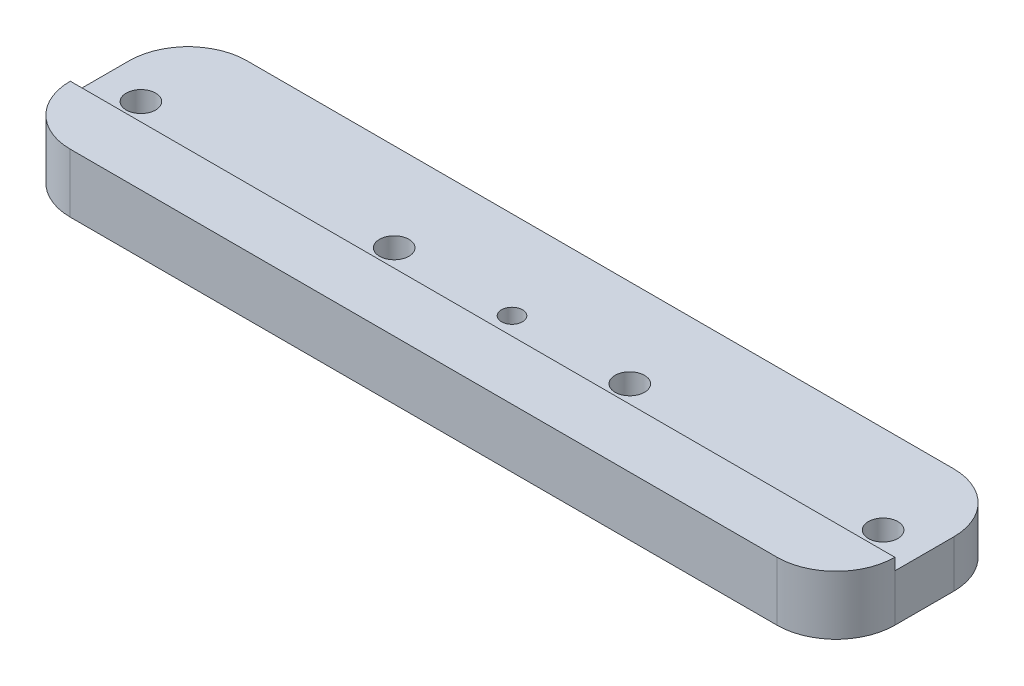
SolidWorks part; units mm, degrees
ref_plane "Front Plane" through (0, 0, 0) normal (0, 0, 1) x (1, 0, 0)
ref_plane "Top Plane" through (0, 0, 0) normal (0, 1, 0) x (1, 0, 0)
ref_plane "Right Plane" through (0, 0, 0) normal (1, 0, 0) x (0, 0, -1)
sketch "Sketch1" plane through (0, 0, 0) normal (0, 1, 0) x (1, 0, 0)
  line L1 (-44.45, -9.525) -> (44.45, -9.525)
  line L2 (-44.45, -9.525) -> (-44.45, 9.525)
  line L3 (-44.45, 9.525) -> (44.45, 9.525)
  line L4 (44.45, -9.525) -> (44.45, 9.525)
  line L5 (-44.45, -9.525) -> (44.45, 9.525) construction
  line L6 (-44.45, 9.525) -> (44.45, -9.525) construction
  point P0 (0, 0)
  dimension "D1" = 88.9
  dimension "D2" = 19.05
extrude "Extrude1" add sketch "Sketch1" along normal blind 6.35
sketch "Sketch2" plane through (0, 6.35, 0) normal (0, 1, 0) x (-1, 0, 0)
  point P0 (0, 0)
sketch "Sketch4" plane through (0, 6.35, 0) normal (0, 1, 0) x (-1, 0, 0)
  line L0 (44.45, -9.525) -> (44.45, 9.525) construction
  line L1 (-44.45, 9.525) -> (-44.45, -9.525) construction
  point P0 (40.005, 0)
  point P1 (-40.005, 0)
  point P6 (-44.45, 0)
  point P9 (12.7, 0)
  point P10 (-12.7, 0)
  dimension "D1" = 4.445
  dimension "D2" = 4.445
  dimension "D3" = 12.7
  dimension "D4" = 12.7
hole_wizard "#4 Clearance Hole1" positions "3DSketch2" profile "Sketch5" hole size "#4" standard "Ansi Inch"
sketch3d "3DSketch2"
  point P0 (-40.005, 6.35, 0)
  point P3 (40.005, 6.35, 0)
  point P6 (-12.7, 6.35, 0)
  point P9 (12.7, 6.35, 0)
sketch "Sketch5" plane through (-40.005, 6.35, 0) normal (1, 0, 0) x (0, 0, 1)
  line L0 (0, 0) -> (0, 10.3519)
  line L1 (0, 10.3519) -> (1.5875, 9.398)
  line L2 (1.5875, 9.398) -> (1.5875, 0)
  line L5 (1.5875, 0) -> (0, 0)
  line L10 (0, 10.3519) -> (-1.5875, 9.398) construction
  line L11 (0, -6.35) -> (0, 107.95) construction
  dimension "Hole Dia." = 3.175
  dimension "Hole Depth" = 9.398
  dimension "Drill Angle" = 118
fillet "Fillet1" radius 6.35 4 edges at (44.45, 3.175, -9.525) (44.45, 3.175, 9.525) (-44.45, 3.175, -9.525) (-44.45, 3.175, 9.525)
sketch "Sketch7" plane through (0, 6.35, 0) normal (0, 1, 0) x (1, 0, 0)
  line L0 (-44.45, -3.175) -> (44.45, -3.175)
  line L1 (44.45, -3.175) -> (44.45, 3.175) construction
  line L2 (38.1, 9.525) -> (-38.1, 9.525) construction
  line L3 (-44.45, 3.175) -> (-44.45, -3.175) construction
  line L4 (44.45, -3.175) -> (44.45, 3.175)
  line L5 (38.1, 9.525) -> (-38.1, 9.525)
  line L6 (-44.45, 3.175) -> (-44.45, -3.175)
  arc A0 (44.45, 3.175) -> (38.1, 9.525) centre (38.1, 3.175) ccw construction
  arc A1 (-38.1, 9.525) -> (-44.45, 3.175) centre (-38.1, 3.175) ccw construction
  arc A2 (44.45, 3.175) -> (38.1, 9.525) centre (38.1, 3.175) ccw
  arc A3 (-38.1, 9.525) -> (-44.45, 3.175) centre (-38.1, 3.175) ccw
extrude "Extrude3" cut sketch "Sketch7" against normal blind 1.27
hole_wizard "#4-40 Tapped Hole1" positions "Sketch9" profile "Sketch8" tap size "#4-40" standard "Ansi Inch"
sketch "Sketch9" plane through (0, 5.08, 0) normal (0, 1, 0) x (-1, 0, 0)
  point P1 (0, 0)
sketch "Sketch8" plane through (0, 5.08, 0) normal (1, 0, 0) x (0, 0, 1)
  line L0 (0, 0) -> (0, 8.2992)
  line L1 (0, 8.2992) -> (1.1303, 7.62)
  line L2 (1.1303, 7.62) -> (1.1303, 0)
  line L5 (1.1303, 0) -> (0, 0)
  line L10 (0, 8.2992) -> (-1.1303, 7.62) construction
  line L11 (0, -6.35) -> (0, 107.95) construction
  dimension "Tap Drill Dia." = 2.2606
  dimension "Tap Drill Depth" = 7.62
  dimension "Drill Angle" = 118
